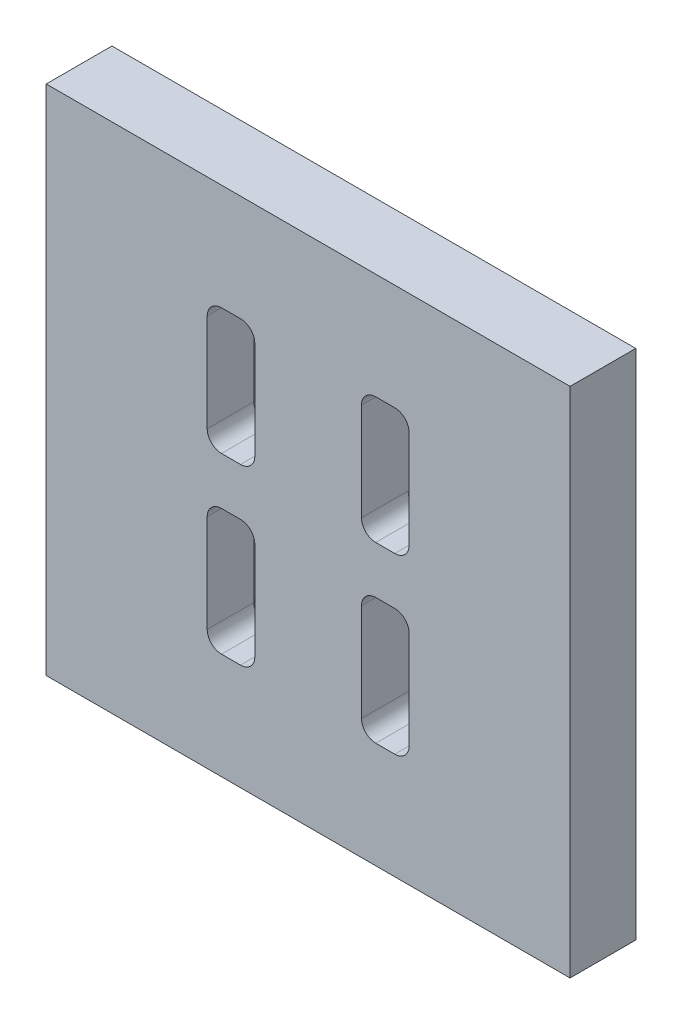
SolidWorks part; units mm, degrees
ref_plane "Front Plane" through (0, 0, 0) normal (0, 0, 1) x (1, 0, 0)
ref_plane "Top Plane" through (0, 0, 0) normal (0, 1, 0) x (1, 0, 0)
ref_plane "Right Plane" through (0, 0, 0) normal (1, 0, 0) x (0, 0, -1)
sketch "Sketch1" plane through (0, 0, 0) normal (0, 0, 1) x (1, 0, 0)
  line L1 (0, 0) -> (69.85, 0)
  line L2 (0, 0) -> (0, 68.326)
  line L3 (0, 68.326) -> (69.85, 68.326)
  line L4 (69.85, 0) -> (69.85, 68.326)
  dimension "D1" = 68.326
  dimension "D2" = 69.85
extrude "Boss-Extrude1" add sketch "Sketch1" along normal blind 8.763
sketch "Sketch2" plane through (0, 0, 8.763) normal (0, 0, 1) x (1, 0, 0)
  point P0 (10.668, 52.2605)
  point P1 (25.908, 52.2605)
  point P3 (25.908, 16.0655)
  point P5 (10.668, 16.0655)
  point P7 (43.942, 16.0655)
  point P9 (59.182, 16.0655)
  point P11 (59.182, 52.2605)
  point P13 (43.942, 52.2605)
sketch "Sketch5" plane through (0, 0, 0) normal (0, 0, -1) x (-1, 0, 0)
  line L0 (-27.813, 52.2605) -> (-27.813, 16.0655)
  line L1 (-59.182, 52.2605) -> (-43.942, 52.2605) construction
  line L2 (-59.182, 52.2605) -> (-59.182, 16.0655) construction
  line L3 (-59.182, 16.0655) -> (-43.942, 16.0655) construction
  line L4 (-43.942, 52.2605) -> (-43.942, 16.0655) construction
  line L5 (-25.908, 52.2605) -> (-10.668, 52.2605) construction
  line L6 (-25.908, 52.2605) -> (-25.908, 16.0655) construction
  line L7 (-25.908, 16.0655) -> (-10.668, 16.0655) construction
  line L8 (-10.668, 52.2605) -> (-10.668, 16.0655) construction
  line L9 (-25.908, 14.1605) -> (-10.668, 14.1605)
  line L10 (-8.763, 52.2605) -> (-8.763, 16.0655)
  line L11 (-25.908, 54.1655) -> (-10.668, 54.1655)
  line L12 (-59.182, 54.1655) -> (-43.942, 54.1655)
  line L13 (-42.037, 52.2605) -> (-42.037, 16.0655)
  line L14 (-59.182, 14.1605) -> (-43.942, 14.1605)
  line L15 (-61.087, 52.2605) -> (-61.087, 16.0655)
  line L16 (-27.813, 54.1655) -> (-27.813, 14.1605) construction
  line L17 (-27.813, 54.1655) -> (-8.763, 54.1655) construction
  line L18 (-8.763, 54.1655) -> (-8.763, 14.1605) construction
  line L19 (-27.813, 14.1605) -> (-8.763, 14.1605) construction
  line L20 (-61.087, 14.1605) -> (-42.037, 14.1605) construction
  line L21 (-61.087, 54.1655) -> (-61.087, 14.1605) construction
  line L22 (-42.037, 54.1655) -> (-42.037, 14.1605) construction
  line L23 (-61.087, 54.1655) -> (-42.037, 54.1655) construction
  arc A0 (-27.813, 52.2605) -> (-25.908, 54.1655) centre (-25.908, 52.2605) cw
  arc A1 (-8.763, 52.2605) -> (-10.668, 54.1655) centre (-10.668, 52.2605) ccw
  arc A2 (-10.668, 14.1605) -> (-8.763, 16.0655) centre (-10.668, 16.0655) ccw
  arc A3 (-27.813, 16.0655) -> (-25.908, 14.1605) centre (-25.908, 16.0655) ccw
  arc A4 (-59.182, 14.1605) -> (-61.087, 16.0655) centre (-59.182, 16.0655) cw
  arc A5 (-42.037, 16.0655) -> (-43.942, 14.1605) centre (-43.942, 16.0655) cw
  arc A6 (-43.942, 54.1655) -> (-42.037, 52.2605) centre (-43.942, 52.2605) cw
  arc A7 (-59.182, 54.1655) -> (-61.087, 52.2605) centre (-59.182, 52.2605) ccw
  dimension "D3" = 1.905
  dimension "D1" = 1.905
  dimension "D2" = 1.905
extrude "Cut-Extrude3" cut sketch "Sketch5" against normal blind 2.54
sketch "Sketch3" plane through (0, 0, 0) normal (0, 0, -1) x (-1, 0, 0)
  line L1 (-59.182, 54.1655) -> (-43.942, 54.1655) construction
  line L2 (-46.482, 54.1655) -> (-43.942, 54.1655)
  line L3 (-48.387, 52.2605) -> (-48.387, 39.243)
  line L4 (-46.482, 37.338) -> (-43.942, 37.338)
  line L6 (-73.1959, 34.163) -> (2.2036, 34.163) construction
  line L7 (-34.925, 59.9732) -> (-34.925, -3.0968) construction
  line L9 (-69.85, 0) -> (-69.85, 68.326) construction
  line L10 (0, 0) -> (-69.85, 0) construction
  line L11 (-42.037, 52.2605) -> (-42.037, 39.243)
  line L12 (-42.037, 52.2605) -> (-42.037, 16.0655) construction
  line L13 (-23.368, 54.1655) -> (-25.908, 54.1655)
  line L14 (-27.813, 52.2605) -> (-27.813, 39.243)
  line L15 (-23.368, 37.338) -> (-25.908, 37.338)
  line L16 (-21.463, 52.2605) -> (-21.463, 39.243)
  line L17 (-23.368, 14.1605) -> (-25.908, 14.1605)
  line L18 (-21.463, 16.0655) -> (-21.463, 29.083)
  line L19 (-23.368, 30.988) -> (-25.908, 30.988)
  line L20 (-27.813, 16.0655) -> (-27.813, 29.083)
  line L21 (-46.482, 14.1605) -> (-43.942, 14.1605)
  line L22 (-48.387, 16.0655) -> (-48.387, 29.083)
  line L23 (-46.482, 30.988) -> (-43.942, 30.988)
  line L24 (-42.037, 16.0655) -> (-42.037, 29.083)
  arc A0 (-48.387, 39.243) -> (-46.482, 37.338) centre (-46.482, 39.243) ccw
  arc A1 (-43.942, 37.338) -> (-42.037, 39.243) centre (-43.942, 39.243) ccw
  arc A2 (-43.942, 54.1655) -> (-42.037, 52.2605) centre (-43.942, 52.2605) cw
  arc A3 (-46.482, 54.1655) -> (-48.387, 52.2605) centre (-46.482, 52.2605) ccw
  arc A4 (-23.368, 54.1655) -> (-21.463, 52.2605) centre (-23.368, 52.2605) cw
  arc A5 (-25.908, 54.1655) -> (-27.813, 52.2605) centre (-25.908, 52.2605) ccw
  arc A6 (-25.908, 37.338) -> (-27.813, 39.243) centre (-25.908, 39.243) cw
  arc A7 (-21.463, 39.243) -> (-23.368, 37.338) centre (-23.368, 39.243) cw
  arc A8 (-25.908, 14.1605) -> (-27.813, 16.0655) centre (-25.908, 16.0655) cw
  arc A9 (-23.368, 14.1605) -> (-21.463, 16.0655) centre (-23.368, 16.0655) ccw
  arc A10 (-21.463, 29.083) -> (-23.368, 30.988) centre (-23.368, 29.083) ccw
  arc A11 (-25.908, 30.988) -> (-27.813, 29.083) centre (-25.908, 29.083) ccw
  arc A12 (-43.942, 14.1605) -> (-42.037, 16.0655) centre (-43.942, 16.0655) ccw
  arc A13 (-46.482, 14.1605) -> (-48.387, 16.0655) centre (-46.482, 16.0655) cw
  arc A14 (-48.387, 29.083) -> (-46.482, 30.988) centre (-46.482, 29.083) cw
  arc A15 (-43.942, 30.988) -> (-42.037, 29.083) centre (-43.942, 29.083) cw
  point P20 (-42.037, 37.338)
  point P23 (-42.037, 54.1655)
  point P26 (-48.387, 54.1655)
  dimension "D5" = 1.905
  dimension "D1" = 34.925
  dimension "D2" = 34.163
  dimension "D3" = 3.175
  dimension "D4" = 6.35
extrude "Cut-Extrude1" cut sketch "Sketch3" against normal through all
